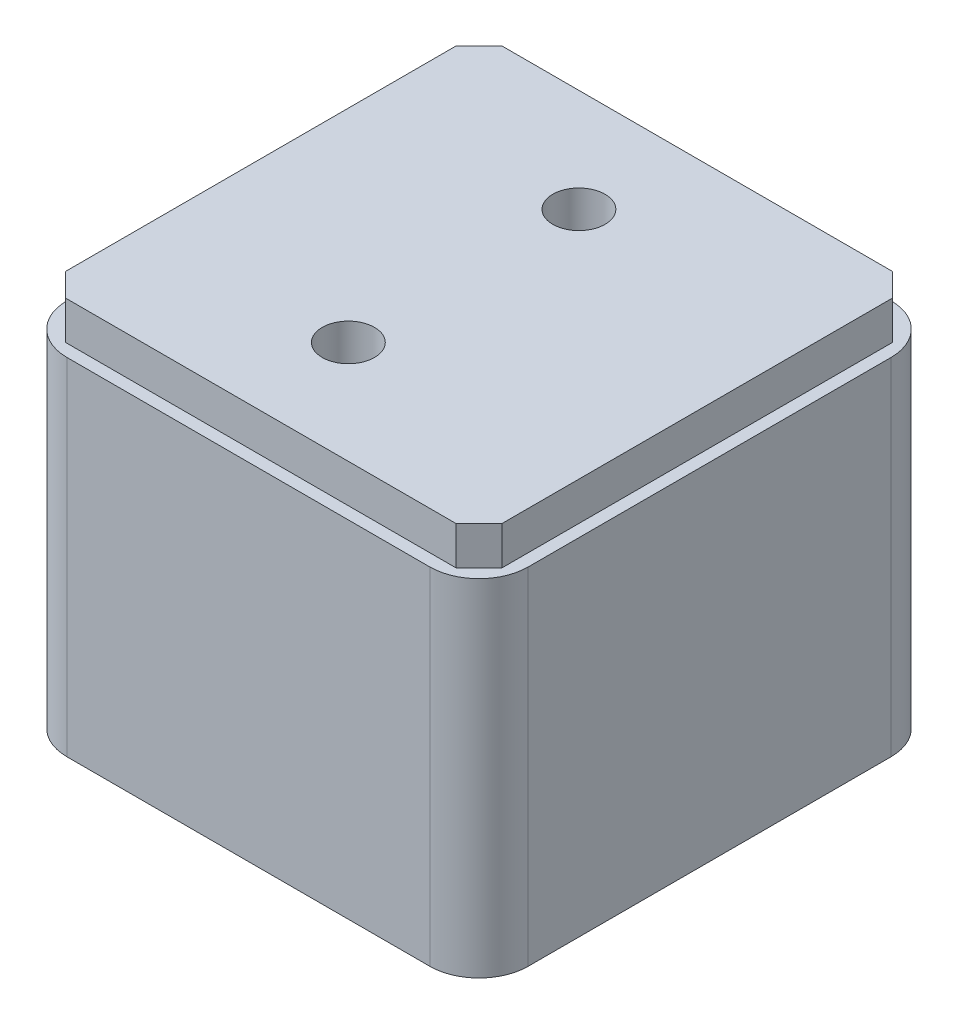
SolidWorks part; units mm, degrees
ref_plane "Plan de face" through (0, 0, 0) normal (0, 0, 1) x (1, 0, 0)
ref_plane "Plan de dessus" through (0, 0, 0) normal (0, 1, 0) x (1, 0, 0)
ref_plane "Plan de droite" through (0, 0, 0) normal (1, 0, 0) x (0, 0, -1)
sketch "Esquisse1" plane through (0, 0, 0) normal (0, 0, 1) x (1, 0, 0)
  line L0 (0, 0) -> (0, 50)
  dimension "D1" = 50
other "Elément mécano-soudé1"
ref_plane "Plan1" through (0, 0, 0) normal (0, 1, 0) x (-1, 0, 0)
sketch "Sketch1" plane through (0, 0, 0) normal (0, 1, 0) x (-1, 0, 0)
  line L0 (-23.6, -26.8) -> (23.6, -26.8)
  line L1 (-26.8, -23.6) -> (-26.8, 23.6)
  line L2 (23.6, 26.8) -> (-23.6, 26.8)
  line L3 (26.8, 23.6) -> (26.8, -23.6)
  line L4 (-23.6, -30) -> (23.6, -30)
  line L5 (-30, -23.6) -> (-30, 23.6)
  line L6 (23.6, 30) -> (-23.6, 30)
  line L7 (30, 23.6) -> (30, -23.6)
  line L8 (-30, 0) -> (-26.8, 0) construction
  line L9 (-26.8, 0) -> (26.8, 0) construction
  line L10 (26.8, 0) -> (30, 0) construction
  line L12 (0, 30) -> (0, 26.8) construction
  line L13 (0, 26.8) -> (0, -26.8) construction
  line L14 (0, -26.8) -> (0, -30) construction
  arc A0 (30, 23.6) -> (23.6, 30) centre (23.6, 23.6) ccw
  arc A1 (23.6, -30) -> (30, -23.6) centre (23.6, -23.6) ccw
  arc A2 (-30, -23.6) -> (-23.6, -30) centre (-23.6, -23.6) ccw
  arc A3 (-23.6, 30) -> (-30, 23.6) centre (-23.6, 23.6) ccw
  arc A4 (-23.6, 26.8) -> (-26.8, 23.6) centre (-23.6, 23.6) ccw
  arc A5 (26.8, 23.6) -> (23.6, 26.8) centre (23.6, 23.6) ccw
  arc A6 (23.6, -26.8) -> (26.8, -23.6) centre (23.6, -23.6) ccw
  arc A7 (-26.8, -23.6) -> (-23.6, -26.8) centre (-23.6, -23.6) ccw
  point P2 (-30, 30)
  point P33 (-30, -30)
  point P34 (30, -30)
  point P36 (30, 30)
  point P37 (0, 0)
  dimension "D1" = 6.4
  dimension "Thickness" = 3.2
  dimension "V_leg" = 60
  dimension "H_leg" = 60
other "Embout1" parameters "D1"=5, "D2"=3, "D3"=3
sketch "Esquisse3" plane through (0, 50, 0) normal (0, 1, 0) x (-1, 0, 0)
  line L0 (2, -15) -> (2, 15) construction
  line L1 (30, -23.6) -> (30, 23.6) construction
  point P0 (2, 15)
  point P2 (2, -15)
  point P4 (2, 0)
  dimension "D1" = 30
  dimension "D2" = 28
hole_wizard "Trou taraudé M81" positions "Esquisse3D1" profile "Esquisse4" tap size "M8" standard "ISO"
sketch3d "Esquisse3D1"
  point P0 (-2, 50, -15)
  point P3 (-2, 50, 15)
sketch "Esquisse4" plane through (-2, 50, -15) normal (1, 0, 0) x (0, 0, 1)
  line L0 (0, 0) -> (0, 31.7929)
  line L1 (0, 31.7929) -> (3.4, 29.75)
  line L2 (3.4, 29.75) -> (3.4, 0)
  line L5 (3.4, 0) -> (0, 0)
  line L10 (0, 31.7929) -> (-3.4, 29.75) construction
  line L11 (0, -6.35) -> (0, 107.95) construction
  dimension "Diamètre du trou pour taraudage" = 6.8
  dimension "Profondeur du trou pour taraudage" = 29.75
  dimension "Angle de pointe" = 118
